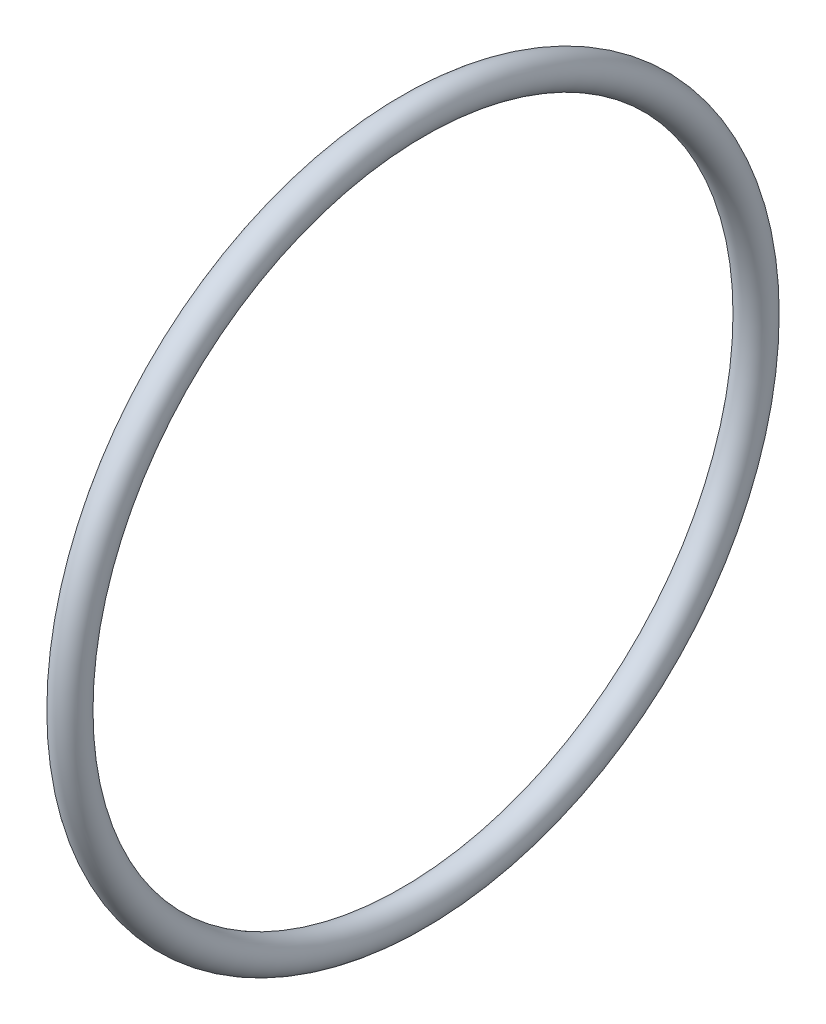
SolidWorks part; units mm, degrees
ref_plane "Vorne" through (0, 0, 0) normal (0, 0, 1) x (1, 0, 0)
ref_plane "Oben" through (0, 0, 0) normal (0, 1, 0) x (1, 0, 0)
ref_plane "Rechts" through (0, 0, 0) normal (1, 0, 0) x (0, 0, -1)
sketch "Skizze1" plane through (0, 0, 0) normal (0, 0, 1) x (1, 0, 0)
  line L0 (0, 0) -> (1.3937, 0) construction
  line L1 (0, 0) -> (27.3437, 0) construction
  circle A0 centre (0, 31.5) radius 1.5
  dimension "D1" = 3
  dimension "D2" = 60
revolve "Rotation1" add sketch "Skizze1" angle 360 about L0
